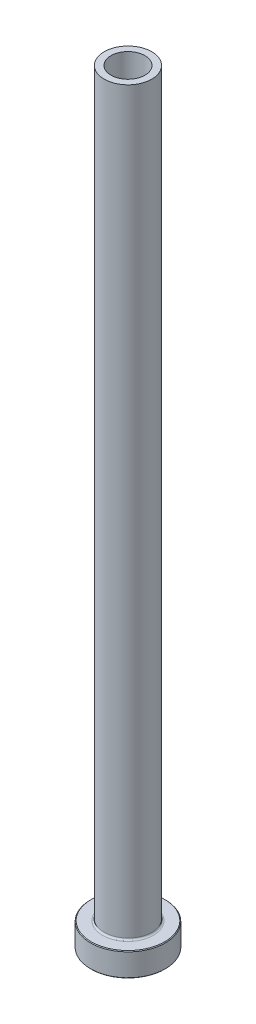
SolidWorks part; units mm, degrees
ref_plane "Front Plane" through (0, 0, 0) normal (0, 0, 1) x (1, 0, 0)
ref_plane "Top Plane" through (0, 0, 0) normal (0, 1, 0) x (1, 0, 0)
ref_plane "Right Plane" through (0, 0, 0) normal (1, 0, 0) x (0, 0, -1)
sketch "Sketch1" plane through (0, 0, 0) normal (0, 0, 1) x (1, 0, 0)
  line L0 (-5, 225) -> (-7, 225)
  line L1 (-7, 225) -> (-7, 7)
  line L2 (-7, 7) -> (-11, 7)
  line L3 (-11, 7) -> (-11, 0)
  line L4 (12.1, 0) -> (-12.1, 0) construction
  line L5 (-11, 0) -> (-5.25, 0)
  line L6 (-5, 180) -> (-5, 225)
  line L7 (0, 92.1877) -> (0, -15.5353) construction
  line L8 (0, -12.1) -> (0, 12.1) construction
  line L9 (-5, 180) -> (-5.25, 168)
  line L10 (-5.25, 168) -> (-5.25, 0)
  dimension "D1" = 0.25
  dimension "ID" = 10
  dimension "OD" = 14
  dimension "L" = 225
  dimension "H" = 22
  dimension "T" = 7
  dimension "N" = 45
  dimension "D2" = 12
revolve "Revolve1" add sketch "Sketch1" angle 360 about L7
fillet "Fillet1" radius 0.5 1 edges at (0, 7, 7)
chamfer "Chamfer1" distance 0.2 angle 45 2 edges at (0, 7, 11) (0, 0, 11)
chamfer "Chamfer3" distance 0.5 angle 45 1 edges at (0, 0, 5.25)
